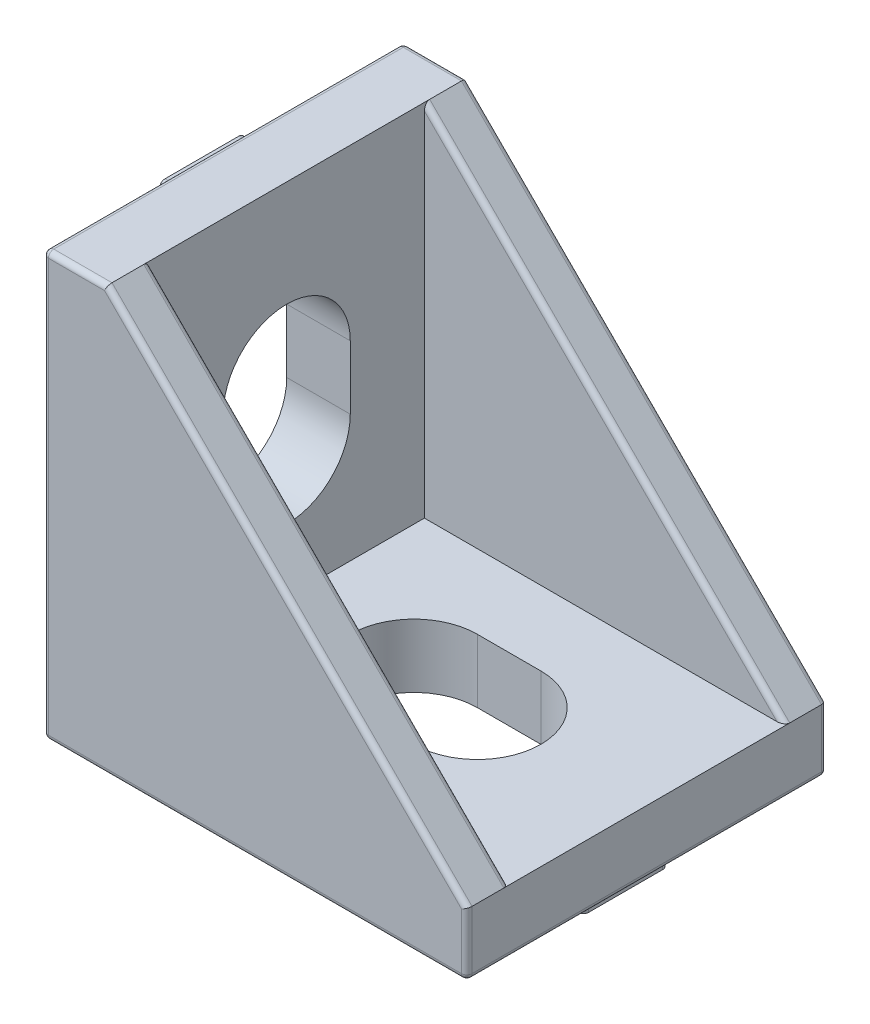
SolidWorks part; units mm, degrees
ref_plane "Front Plane" through (0, 0, 0) normal (0, 0, 1) x (1, 0, 0)
ref_plane "Top Plane" through (0, 0, 0) normal (0, 1, 0) x (1, 0, 0)
ref_plane "Right Plane" through (0, 0, 0) normal (1, 0, 0) x (0, 0, -1)
ref_plane "Plane1" through (0, 0, 6.5) normal (0, 0, -1) x (-1, 0, 0)
sketch "Sketch1" plane through (0, 0, 6.5) normal (0, 0, -1) x (-1, 0, 0)
  line L0 (-20, 3) -> (0, 3)
  line L1 (0, 3) -> (0, 20)
  line L2 (0, 20) -> (-3, 20)
  line L3 (-3, 20) -> (-20, 3)
extrude "Boss-Extrude1" add sketch "Sketch1" against normal blind 2
sketch "Sketch2" plane through (0, 0, 6.5) normal (0, 0, -1) x (-1, 0, 0)
  line L0 (-3, 3) -> (-3, 20)
  line L1 (-3, 20) -> (0, 20)
  line L2 (0, 20) -> (0, 3)
  line L3 (0, 3) -> (-3, 3)
extrude "Boss-Extrude2" add sketch "Sketch2" along normal blind 13
sketch "Sketch3" plane through (0, 0, -6.5) normal (0, 0, -1) x (-1, 0, 0)
  line L0 (-20, 3) -> (-3, 20)
  line L1 (-3, 20) -> (0, 20)
  line L2 (0, 20) -> (0, 3)
  line L3 (0, 3) -> (-20, 3)
extrude "Boss-Extrude3" add sketch "Sketch3" along normal blind 2
sketch "Sketch4" plane through (0, 3, 0) normal (0, -1, 0) x (1, 0, 0)
  line L0 (20, 8.5) -> (20, -8.5)
  line L1 (20, -8.5) -> (0, -8.5)
  line L2 (0, -8.5) -> (0, 8.5)
  line L3 (0, 8.5) -> (20, 8.5)
extrude "Boss-Extrude4" add sketch "Sketch4" along normal blind 3
sketch "Sketch5" plane through (3, 0, 0) normal (1, 0, 0) x (0, 0, -1)
  line L0 (3, 9) -> (3, 12)
  line L1 (-3, 12) -> (-3, 9)
  arc A0 (-3, 9) -> (3, 9) centre (0, 9) ccw
  arc A1 (3, 12) -> (-3, 12) centre (0, 12) ccw
extrude "Cut-Extrude1" cut sketch "Sketch5" against normal through all
sketch "Sketch6" plane through (0, 0, 0) normal (0, -1, 0) x (1, 0, 0)
  line L0 (9, -3) -> (12, -3)
  line L1 (12, 3) -> (9, 3)
  arc A0 (12, -3) -> (12, 3) centre (12, 0) ccw
  arc A1 (9, 3) -> (9, -3) centre (9, 0) ccw
extrude "Cut-Extrude2" cut sketch "Sketch6" against normal through all
sketch "Sketch7" plane through (0, 0, 0) normal (-1, 0, 0) x (0, 0, 1)
  line L0 (-2, 19) -> (2, 19)
  line L1 (2, 19) -> (2, 17)
  line L2 (2, 17) -> (-2, 17)
  line L3 (-2, 17) -> (-2, 19)
extrude "Boss-Extrude5" add sketch "Sketch7" along normal blind 1
sketch "Sketch8" plane through (0, 0, 0) normal (-1, 0, 0) x (0, 0, 1)
  line L0 (-2, 4) -> (2, 4)
  line L1 (2, 4) -> (2, 2)
  line L2 (2, 2) -> (-2, 2)
  line L3 (-2, 2) -> (-2, 4)
extrude "Boss-Extrude6" add sketch "Sketch8" along normal blind 1
sketch "Sketch9" plane through (0, 0, 0) normal (0, -1, 0) x (1, 0, 0)
  line L0 (4, 2) -> (4, -2)
  line L1 (4, -2) -> (2, -2)
  line L2 (2, -2) -> (2, 2)
  line L3 (2, 2) -> (4, 2)
extrude "Boss-Extrude7" add sketch "Sketch9" along normal blind 1
sketch "Sketch10" plane through (0, 0, 0) normal (0, -1, 0) x (1, 0, 0)
  line L0 (19, 2) -> (19, -2)
  line L1 (19, -2) -> (17, -2)
  line L2 (17, -2) -> (17, 2)
  line L3 (17, 2) -> (19, 2)
extrude "Boss-Extrude8" add sketch "Sketch10" along normal blind 1
fillet "Fillet2" radius 0.25 31 edges at (11.5, 11.5, 6.5) (11.5, 11.5, 8.5) (20, 1.5, 8.5) (10, 0, 8.5) (0, 10, -8.5) (0, 10, 8.5) (1.5, 20, 8.5) (1.5, 20, -8.5) (10, 0, -8.5) (20, 1.5, -8.5) (11.5, 11.5, -6.5) (11.5, 11.5, -8.5) (0, 0, 0) (19, -0.5, 2) (17, -0.5, 2) (19, -0.5, -2) (17, -0.5, -2) (2, -0.5, 2) (4, -0.5, 2) (4, -0.5, -2) (2, -0.5, -2) (-0.5, 2, -2) (-0.5, 4, -2) (-0.5, 2, 2) (-0.5, 4, 2) (0, 20, 0) (-0.5, 17, 2) (-0.5, 17, -2) (-0.5, 19, -2) (-0.5, 19, 2) (20, 0, 0)
